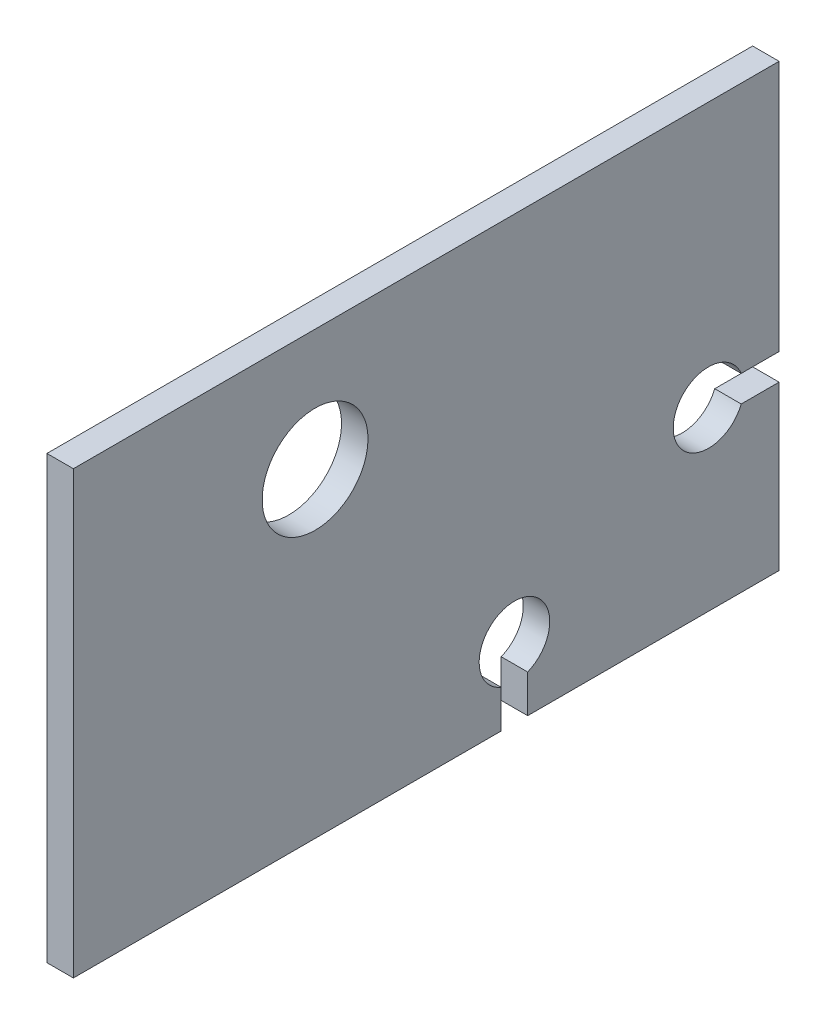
SolidWorks part; units mm, degrees
ref_plane "Face" through (0, 0, 0) normal (0, 0, 1) x (1, 0, 0)
ref_plane "Dessus" through (0, 0, 0) normal (0, 1, 0) x (1, 0, 0)
ref_plane "Droite" through (0, 0, 0) normal (1, 0, 0) x (0, 0, -1)
sketch "Esquisse1" plane through (0, 0, 0) normal (1, 0, 0) x (0, 0, -1)
  line L0 (75.7081, 21.5) -> (80, 21.5)
  line L1 (0, 0) -> (48.5, 0)
  line L2 (0, 0) -> (0, 50)
  line L3 (0, 50) -> (80, 50)
  line L4 (80, 0) -> (80, 18.5)
  line L5 (80, 21.5) -> (80, 50)
  line L6 (75.7081, 18.5) -> (80, 18.5)
  line L7 (72, 20) -> (80, 20) construction
  line L8 (80, 21.5) -> (80, 18.5) construction
  line L9 (50, 0) -> (50, 8) construction
  line L10 (48.5, 4.2919) -> (48.5, 0)
  line L11 (51.5, 4.2919) -> (51.5, 0)
  line L12 (51.5, 0) -> (80, 0)
  line L13 (48.5, 0) -> (51.5, 0) construction
  circle A0 centre (27.4, 36.25) radius 6
  arc A1 (75.7081, 21.5) -> (75.7081, 18.5) centre (72, 20) ccw
  arc A2 (51.5, 4.2919) -> (48.5, 4.2919) centre (50, 8) ccw
  circle A3 centre (-20.6, 36.25) radius 12.5 construction
  dimension "D1" = 12
  dimension "D5" = 4
  dimension "D9" = 48
  dimension "D2" = 80
  dimension "D3" = 50
  dimension "D4" = 3
  dimension "D6" = 8
  dimension "D7" = 20
  dimension "D8" = 30
extrude "Base-Extrusion" add sketch "Esquisse1" along normal mid plane 3
